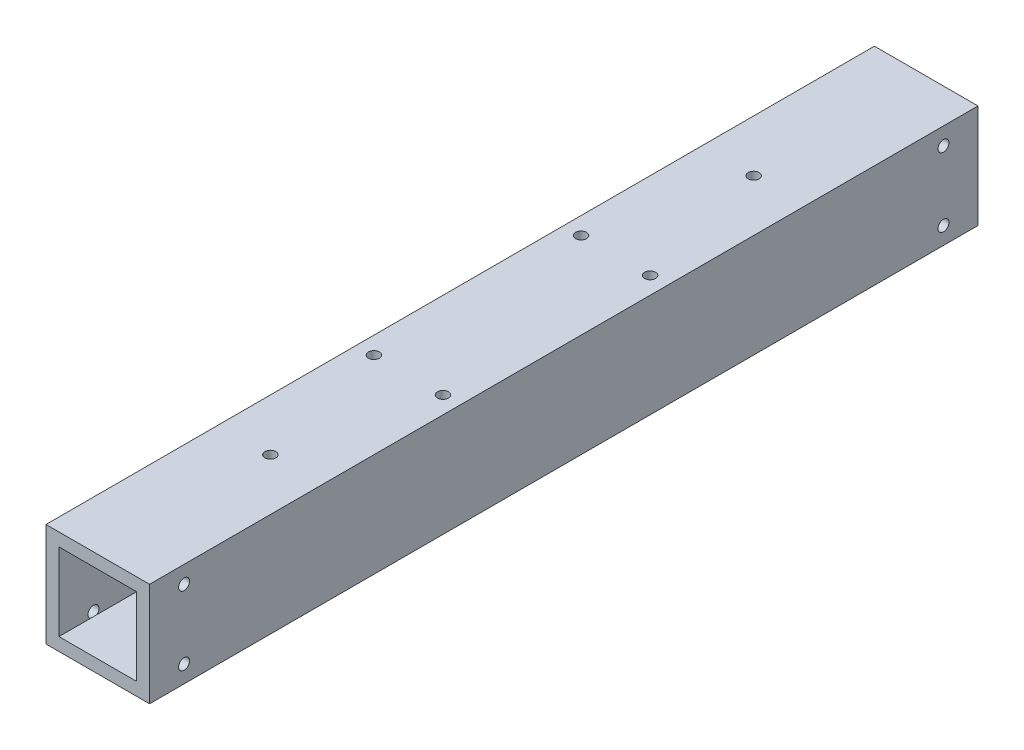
SolidWorks part; units mm, degrees
ref_plane "Front Plane" through (0, 0, 0) normal (0, 0, 1) x (1, 0, 0)
ref_plane "Top Plane" through (0, 0, 0) normal (0, 1, 0) x (1, 0, 0)
ref_plane "Right Plane" through (0, 0, 0) normal (1, 0, 0) x (0, 0, -1)
sketch "Sketch1" plane through (0, 0, 0) normal (0, 1, 0) x (1, 0, 0)
  line L1 (-19.05, 152.4) -> (19.05, 152.4)
  line L2 (-19.05, 152.4) -> (-19.05, -152.4)
  line L3 (-19.05, -152.4) -> (19.05, -152.4)
  line L4 (19.05, 152.4) -> (19.05, -152.4)
  dimension "D1" = 19.05
  dimension "D2" = 19.05
  dimension "D3" = 152.4
  dimension "D4" = 152.4
extrude "Boss-Extrude1" add sketch "Sketch1" along normal mid plane 38.1
sketch "Sketch2" plane through (0, 0, 152.4) normal (0, 0, 1) x (1, 0, 0)
  line L0 (-19.05, 19.05) -> (-19.05, -19.05) construction
  line L1 (-14.2875, 14.2875) -> (14.2875, 14.2875)
  line L2 (-14.2875, 14.2875) -> (-14.2875, -14.2875)
  line L3 (-14.2875, -14.2875) -> (14.2875, -14.2875)
  line L4 (14.2875, 14.2875) -> (14.2875, -14.2875)
  line L5 (19.05, 19.05) -> (19.05, -19.05) construction
  line L6 (-19.05, -19.05) -> (19.05, -19.05) construction
  line L7 (-19.05, 19.05) -> (19.05, 19.05) construction
  dimension "D1" = 4.7625
  dimension "D2" = 4.7625
  dimension "D3" = 4.7625
  dimension "D4" = 4.7625
extrude "Cut-Extrude1" cut sketch "Sketch2" against normal through all
hole_wizard "#10-32 Tapped Hole1" positions "Sketch4" profile "Sketch3" tap size "#10-32" standard "ANSI Inch"
sketch "Sketch4" plane through (19.05, 0, 0) normal (1, 0, 0) x (0, 0, -1)
  line L0 (-152.4, 19.05) -> (-152.4, -19.05) construction
  point P0 (-139.7, 12.7)
  point P2 (-139.7, -12.7)
  dimension "D1" = 12.7
  dimension "D2" = 12.7
  dimension "D3" = 12.7
sketch "Sketch3" plane through (19.05, 12.7, 139.7) normal (0, 1, 0) x (0, 0, -1)
  line L0 (0, 0) -> (0, 4.7635)
  line L1 (0, 4.7635) -> (2.0193, 4.7635)
  line L2 (2.0193, 4.7635) -> (2.0193, 0)
  line L5 (2.0193, 0) -> (0, 0)
  line L11 (0, -6.35) -> (0, 107.95) construction
  dimension "Thru Tap Drill Dia." = 4.0386
  dimension "Thru Tap Drill Depth" = 4.7635
hole_wizard "#10-32 Tapped Hole2" positions "Sketch6" profile "Sketch5" tap size "#10-32" standard "ANSI Inch"
sketch "Sketch6" plane through (0, 19.05, 0) normal (0, 1, 0) x (1, 0, 0)
  point P0 (-12.7, -38.1)
  point P2 (12.7, -38.1)
  dimension "D1" = 12.7
  dimension "D2" = 12.7
  dimension "D3" = 38.1
sketch "Sketch5" plane through (-12.7, 19.05, 38.1) normal (1, 0, 0) x (0, 0, 1)
  line L0 (0, 0) -> (0, 4.7635)
  line L1 (0, 4.7635) -> (2.0193, 4.7635)
  line L2 (2.0193, 4.7635) -> (2.0193, 0)
  line L5 (2.0193, 0) -> (0, 0)
  line L11 (0, -6.35) -> (0, 107.95) construction
  dimension "Thru Tap Drill Dia." = 4.0386
  dimension "Thru Tap Drill Depth" = 4.7635
mirror "Mirror1" about plane through (0, 0, 0) normal (1, 0, 0) of "#10-32 Tapped Hole1"
mirror "Mirror3" about plane through (0, 0, 0) normal (0, 1, 0) of "#10-32 Tapped Hole2"
mirror "Mirror4" about plane through (0, 0, 0) normal (0, 0, 1) of "Mirror3", "Mirror1", "#10-32 Tapped Hole2", "#10-32 Tapped Hole1"
sketch "Sketch7" plane through (0, -19.05, 0) normal (0, -1, 0) x (1, 0, 0)
  circle A0 centre (5.08, 8.89) radius 2.2352
  circle A1 centre (5.08, -8.89) radius 2.2352
  circle A2 centre (-10.16, 0) radius 2.2352
  dimension "D1" = 5.08
  dimension "D2" = 10.16
  dimension "D3" = 8.89
  dimension "D4" = 8.89
extrude "Cut-Extrude2" cut sketch "Sketch7" against normal up to next
sketch "Sketch8" plane through (0, -19.05, 0) normal (0, -1, 0) x (-1, 0, 0)
  circle A0 centre (0, 0) radius 10.16
hole_wizard "#10-32 Tapped Hole3" positions "Sketch10" profile "Sketch9" tap size "#10-32" standard "ANSI Inch"
sketch "Sketch10" plane through (0, 19.05, 0) normal (0, 1, 0) x (1, 0, 0)
  point P0 (0, -88.9)
  point P4 (0, 88.9)
  dimension "D1" = 88.9
  dimension "D2" = 88.9
sketch "Sketch9" plane through (0, 19.05, 88.9) normal (1, 0, 0) x (0, 0, 1)
  line L0 (0, 0) -> (0, 38.1)
  line L1 (0, 38.1) -> (2.0193, 38.1)
  line L2 (2.0193, 38.1) -> (2.0193, 0)
  line L5 (2.0193, 0) -> (0, 0)
  line L11 (0, -6.35) -> (0, 107.95) construction
  dimension "Thru Tap Drill Dia." = 4.0386
  dimension "Thru Tap Drill Depth" = 38.1
mirror "Mirror5" about plane through (0, 0, 0) normal (0, 1, 0) of "#10-32 Tapped Hole3"
hole_wizard "15/64 (0.23438) Diameter Hole1" positions "Sketch12" profile "Sketch11" hole size "15/64" standard "ANSI Inch"
sketch "Sketch12" plane through (0, -19.05, 0) normal (0, -1, 0) x (-1, 0, 0)
  point P0 (0, -63.5)
  point P6 (-15.875, 63.5)
  point P8 (15.875, 63.5)
  dimension "D1" = 63.5
  dimension "D2" = 63.5
  dimension "D3" = 15.875
  dimension "D4" = 15.875
sketch "Sketch11" plane through (0, -19.05, 63.5) normal (1, 0, 0) x (0, 0, -1)
  line L0 (0, 0) -> (0, 3.0585)
  line L1 (0, 3.0585) -> (2.9766, 1.27)
  line L2 (2.9766, 1.27) -> (2.9766, 0)
  line L5 (2.9766, 0) -> (0, 0)
  line L10 (0, 3.0585) -> (-2.9766, 1.27) construction
  line L11 (0, -6.35) -> (0, 107.95) construction
  dimension "Hole Dia." = 5.9533
  dimension "Hole Depth" = 1.27
  dimension "Drill Angle" = 118
